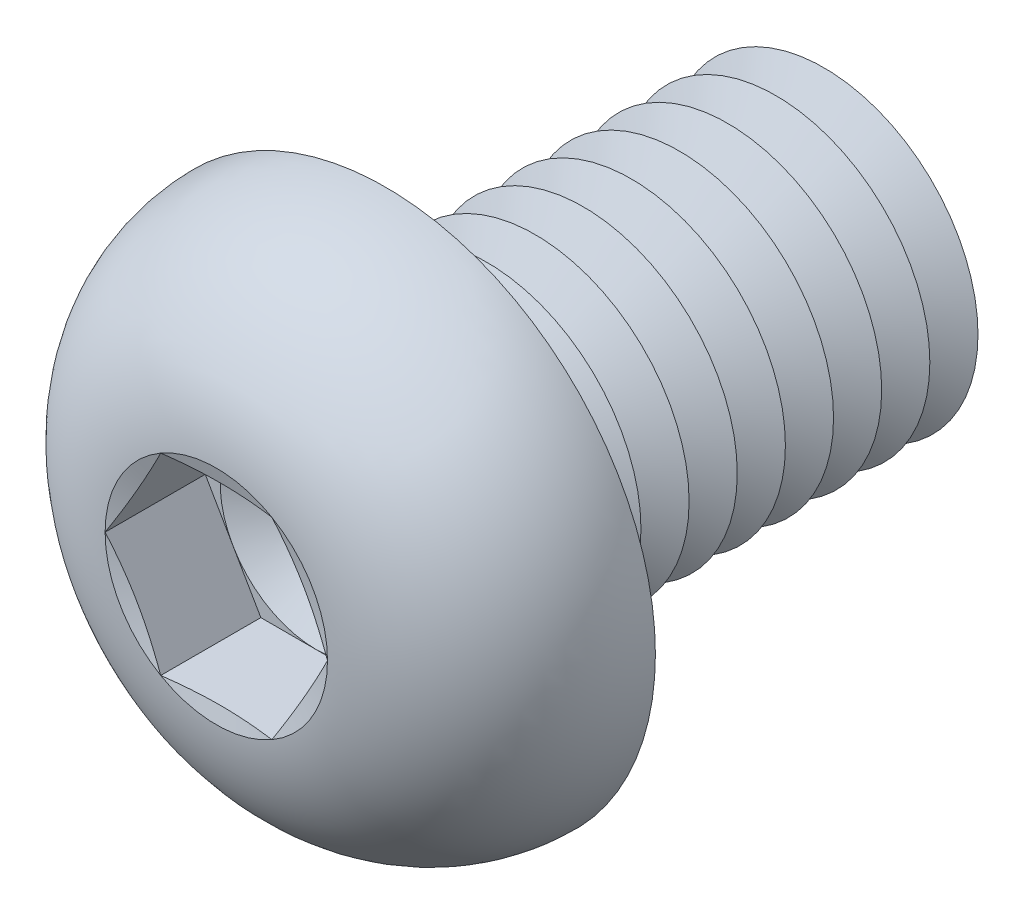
SolidWorks part; units mm, degrees
ref_plane "Front Plane" through (0, 0, 0) normal (0, 0, 1) x (1, 0, 0)
ref_plane "Top Plane" through (0, 0, 0) normal (0, 1, 0) x (1, 0, 0)
ref_plane "Right Plane" through (0, 0, 0) normal (1, 0, 0) x (0, 0, -1)
sketch "Sketch1" plane through (0, 0, 0) normal (1, 0, 0) x (0, 0, -1)
  line L0 (0, 4) -> (0, 7)
  line L3 (0, 4) -> (12, 4)
  line L4 (12, 4) -> (12, 0)
  line L5 (12, 0) -> (-4.4, 0) construction
  line L6 (-4.4, 0) -> (12, 0)
  line L7 (-4.4, 2.8867) -> (-4.4, 1.4434) construction
  line L8 (-4.4, 1.4434) -> (-4.4, 0)
  line L9 (-4.4, 2.8867) -> (-4.0132, 1.4434)
  line L10 (-4.0132, 1.4434) -> (-4.4, 1.4434)
  line L11 (12, 0) -> (22.7481, 0) construction
  line L12 (0, 7) -> (-4.4, 7) construction
  arc A1 (0, 7) -> (-4.4, 2.8867) centre (0, 2.59) ccw
  point P8 (12, 2)
  dimension "D1" = 14
  dimension "D2" = 8
  dimension "D3" = 4.4
  dimension "D4" = 5.7735
  dimension "D5" = 12
  dimension "D6" = 15
revolve "Revolve1" add sketch "Sketch1" angle 360 about L5
fillet "Fillet1" radius 0.625 1 edges at (-4, 0, 0)
sketch "Sketch2" plane through (0, 0, 0) normal (1, 0, 0) x (0, 0, -1)
  line L0 (11.375, 4) -> (12.625, 4)
  line L1 (12, 4) -> (0.625, 4) construction
  line L2 (12.625, 4) -> (12, 2.9175)
  line L3 (12, -4) -> (12, 4) construction
  line L4 (12, 2.9175) -> (11.375, 4)
  dimension "D1" = 1.25
revolve "Cut-Revolve1" cut sketch "Sketch2" angle 360 about axis through (0, 0, -12) along (0, 0, -1)
pattern_linear "LPattern1" count 9 spacing 1.25 along (0, 0, 1) of "Cut-Revolve1"
sketch "Sketch3" plane through (0, 0, 4.4) normal (0, 0, 1) x (1, 0, 0)
  line L7 (1.4434, 2.5) -> (-1.4434, 2.5)
  line L8 (-1.4434, 2.5) -> (-2.8867, 0)
  line L9 (-2.8867, 0) -> (-1.4434, -2.5)
  line L10 (-1.4434, -2.5) -> (1.4434, -2.5)
  line L11 (1.4434, -2.5) -> (2.8867, 0)
  line L12 (2.8867, 0) -> (1.4434, 2.5)
  circle A0 centre (0, 0) radius 2.5 construction
  circle A3 centre (0, 0) radius 2.8867 construction
extrude "Cut-Extrude1" cut sketch "Sketch3" against normal blind 2.6
sketch "Sketch4" plane through (0, 0, 1.8) normal (0, 0, 1) x (1, 0, 0)
  line L1 (1.4434, 2.5) -> (-1.4434, 2.5) construction
  circle A0 centre (0, 0) radius 2.5
extrude "Cut-Extrude2" cut sketch "Sketch4" against normal through all draft 60
